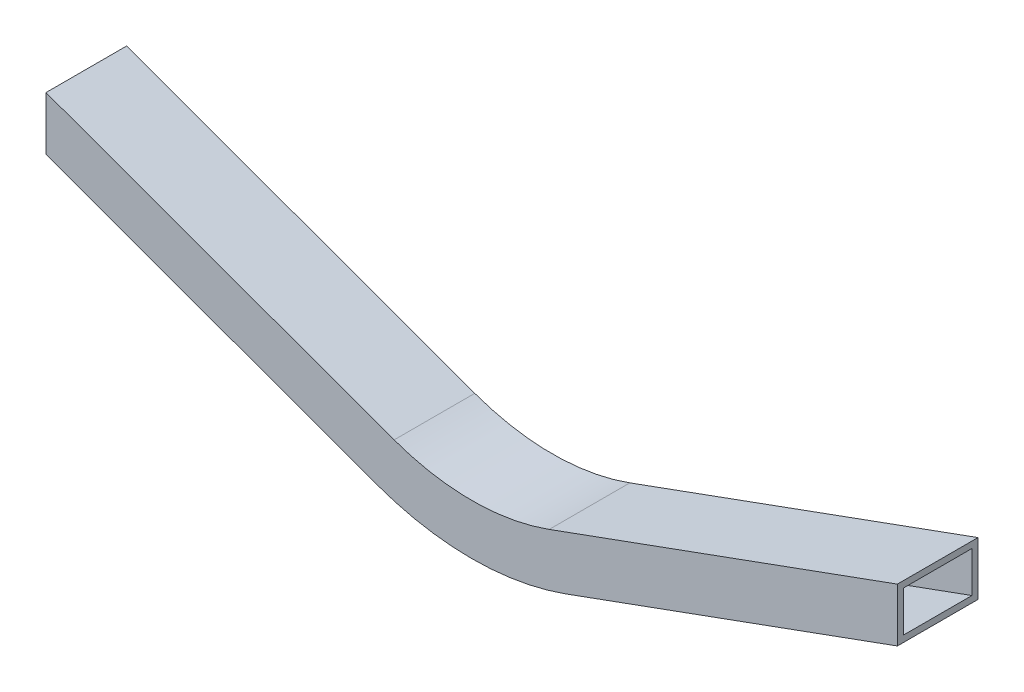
SolidWorks part; units mm, degrees
ref_plane "Plan de face" through (0, 0, 0) normal (0, 0, 1) x (1, 0, 0)
ref_plane "Plan de dessus" through (0, 0, 0) normal (0, 1, 0) x (1, 0, 0)
ref_plane "Plan de droite" through (0, 0, 0) normal (1, 0, 0) x (0, 0, -1)
sketch "Esquisse1" plane through (0, 0, 0) normal (0, 0, 1) x (1, 0, 0)
  line L0 (-61.7579, 0) -> (-51.7579, 0) construction
  line L1 (-85.505, 31.1213) -> (-469.8463, 171.0101)
  line L2 (85.505, 31.1213) -> (469.8463, 171.0101)
  line L3 (0, 57.1973) -> (0, -62.1379) construction
  arc A0 (85.505, 31.1213) -> (-85.505, 31.1213) centre (0, 266.0444) cw
  point P11 (0, 0)
  dimension "D5" = 250
  dimension "D1" = 140
  dimension "D2" = 20
  dimension "D3" = 500
  dimension "D4" = 500
ref_plane "Plan1" through (-469.8463, 171.0101, 0) normal (-0.9397, 0.342, 0) x (0, 0, 1)
sketch "Esquisse2" plane through (-469.8463, 171.0101, 0) normal (-0.9397, 0.342, 0) x (0, 0, 1)
  line L1 (-40, 25) -> (40, 25)
  line L2 (-40, 25) -> (-40, -25)
  line L3 (-40, -25) -> (40, -25)
  line L4 (40, 25) -> (40, -25)
  dimension "D1" = 80
  dimension "D2" = 50
  dimension "D3" = 25
  dimension "D4" = 40
sweep "Balayage-Mince1" add profiles "Esquisse2" path "Esquisse1" parameters "D1"=6
sketch "Esquisse3" plane through (0, 0, 40) normal (0, 0, 1) x (1, 0, 0)
  line L1 (-422.5, 372.4391) -> (422.5, 372.4391)
  line L2 (-422.5, 372.4391) -> (-422.5, -106.4299)
  line L3 (-422.5, -106.4299) -> (422.5, -106.4299)
  line L4 (422.5, 372.4391) -> (422.5, -106.4299)
  dimension "D1" = 422.5
  dimension "D2" = 845
extrude "Enlèv. mat.-Extru.1" cut sketch "Esquisse3" against normal through all flip side to cut
